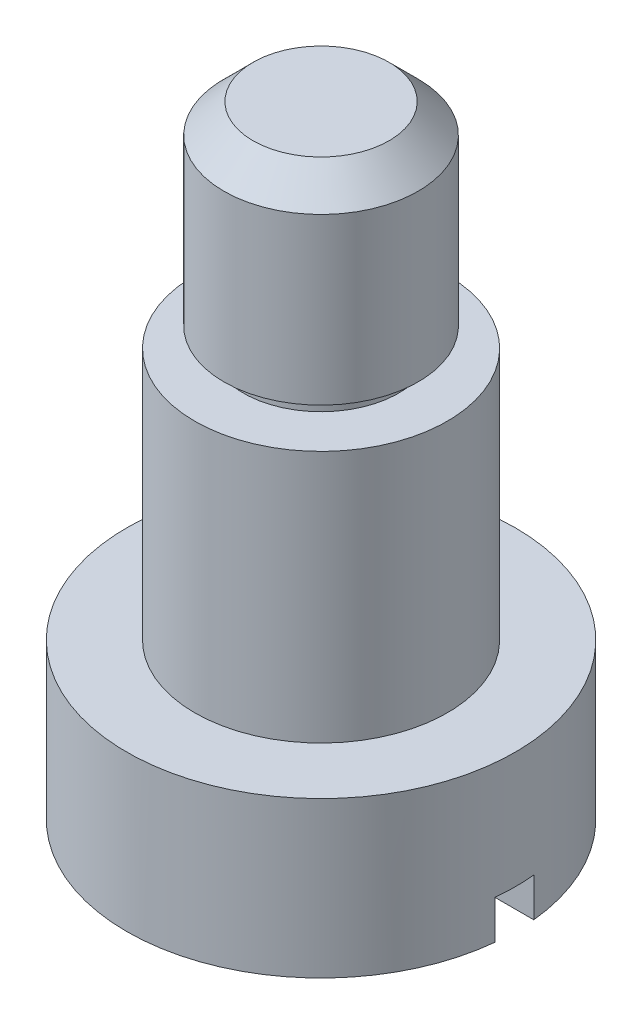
SolidWorks part; units mm, degrees
ref_plane "Face" through (0, 0, 0) normal (0, 0, 1) x (1, 0, 0)
ref_plane "Gauche" through (0, 0, 0) normal (0, 1, 0) x (1, 0, 0)
ref_plane "Dessus" through (0, 0, 0) normal (1, 0, 0) x (0, 0, -1)
sketch "Esquisse1" plane through (0, 0, 0) normal (0, 0, 1) x (1, 0, 0)
  line L0 (0, -26) -> (0, 39) construction
  line L1 (0, 32) -> (5, 32)
  line L2 (5, 32) -> (5, 22)
  line L3 (5, 22) -> (4, 22)
  line L4 (4, 22) -> (4, 21)
  line L5 (4, 21) -> (6.5, 21)
  line L6 (6.5, 21) -> (6.5, 8)
  line L7 (6.5, 8) -> (10, 8)
  line L8 (10, 8) -> (10, 0)
  line L9 (10, 0) -> (0, 0)
  line L10 (0, 0) -> (0, 32)
  dimension "D1" = 5
  dimension "D2" = 4
  dimension "D3" = 6.5
  dimension "D4" = 10
  dimension "D5" = 8
  dimension "D6" = 13
  dimension "D7" = 1
  dimension "D8" = 10
revolve "Base-Révolution" add sketch "Esquisse1"
chamfer "Chanfrein1" distance 1.5 angle 45
sketch "Esquisse2" plane through (0, 0, 0) normal (0, -1, 0) x (1, 0, 0)
  line L0 (9.9499, -1) -> (-9.9499, -1)
  line L1 (9.9499, 1) -> (-9.9499, 1)
  circle A1 centre (0, 0) radius 10 construction
  arc A2 (9.9499, -1) -> (9.9499, 1) centre (0, 0) ccw
  arc A3 (-9.9499, 1) -> (-9.9499, -1) centre (0, 0) ccw
  dimension "D1" = 1
  dimension "D2" = 2
extrude "Enlèv. mat.-Extru.1" cut sketch "Esquisse2" against normal blind 2
